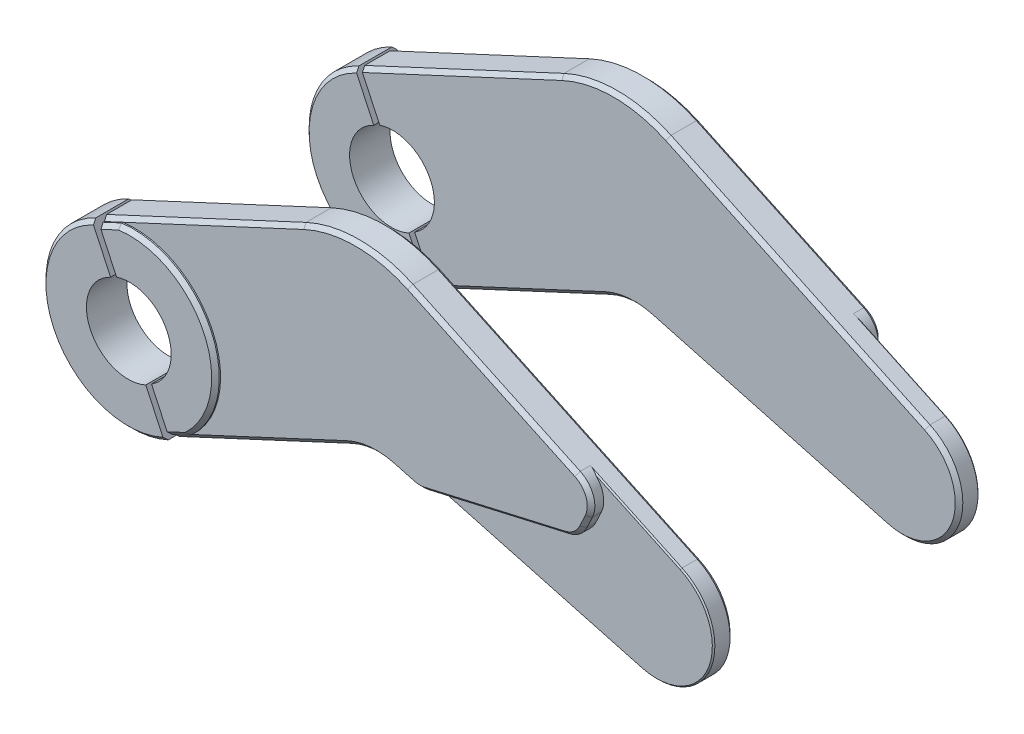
SolidWorks part; units mm, degrees
ref_plane "Front" through (0, 0, 0) normal (0, 0, 1) x (1, 0, 0)
ref_plane "Top" through (0, 0, 0) normal (0, 1, 0) x (1, 0, 0)
ref_plane "Right" through (0, 0, 0) normal (1, 0, 0) x (0, 0, -1)
imported_body "Defeature ausgeführt1"
imported_body "Defeature ausgeführt2"
imported_body "Defeature ausgeführt3"
imported_body "Defeature ausgeführt4"
other "Fläche löschen1"
other "Fläche löschen2"
other "Fläche löschen3"
other "Fläche löschen4"
